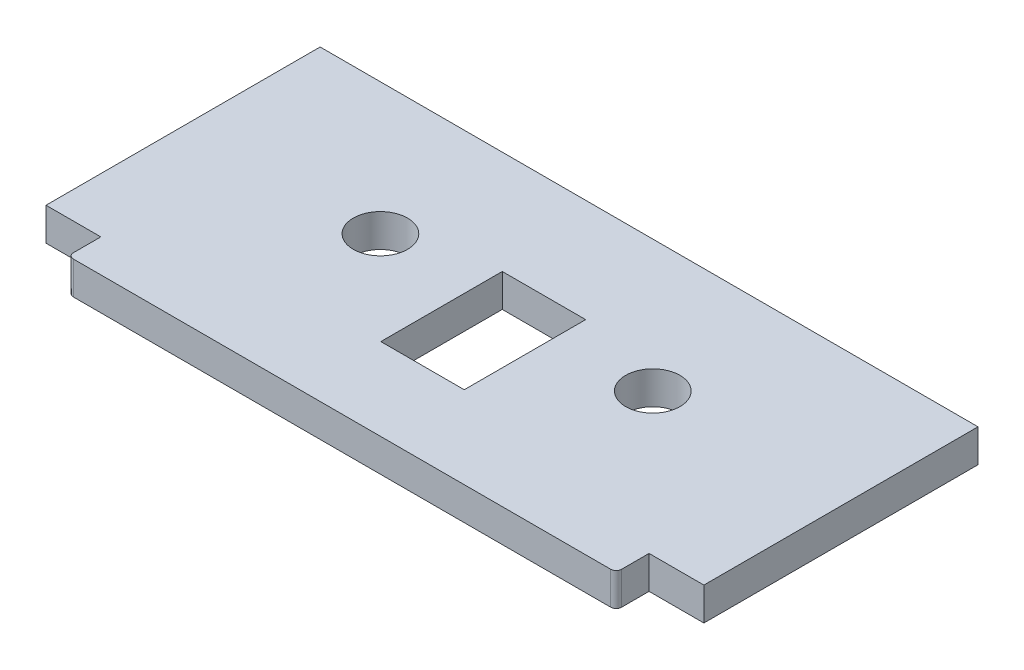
SolidWorks part; units mm, degrees
ref_plane "Front Plane" through (0, 0, 0) normal (0, 0, 1) x (1, 0, 0)
ref_plane "Top Plane" through (0, 0, 0) normal (0, 1, 0) x (1, 0, 0)
ref_plane "Right Plane" through (0, 0, 0) normal (1, 0, 0) x (0, 0, -1)
sketch "Sketch1" plane through (0, 0, 0) normal (0, 1, 0) x (1, 0, 0)
  line L0 (-24.6829, -7.1559) -> (26.6439, -7.1559) construction
  line L1 (-59.6829, 16.8441) -> (60.3171, 16.8441)
  line L2 (-59.6829, 16.8441) -> (-59.6829, -33.1559)
  line L3 (-59.6829, -33.1559) -> (-49.6829, -33.1559)
  line L4 (60.3171, 16.8441) -> (60.3171, -33.1559)
  line L8 (-49.6829, -33.1559) -> (-49.6829, -39.1559)
  line L14 (-7.6072, -18.1559) -> (-7.6072, -24.1559)
  line L15 (-49.6829, -39.1559) -> (50.3171, -39.1559)
  line L16 (50.3171, -39.1559) -> (50.3171, -33.1559)
  line L17 (50.3171, -33.1559) -> (60.3171, -33.1559)
  line L26 (-7.6072, -2.0054) -> (7.6072, -2.0054)
  line L27 (-7.6072, -2.0054) -> (-7.6072, -18.1559)
  line L29 (7.6072, -2.0054) -> (7.6072, -18.1559)
  line L30 (-7.6072, -2.0054) -> (7.6072, -18.1559) construction
  line L31 (-7.6072, -18.1559) -> (7.6072, -2.0054) construction
  line L32 (-7.6072, -24.1559) -> (7.6072, -24.1559)
  line L33 (7.6072, -24.1559) -> (7.6072, -18.1559)
  circle A1 centre (-24.6829, -7.1559) radius 4.95
  circle A2 centre (25, -7.1559) radius 4.95
  point P0 (0, -10.0807)
  point P6 (0, -0.4349)
  point P14 (0, -0.4349)
  dimension "D3" = 26
  dimension "D4" = 24.6829
  dimension "D6" = 9.9
  dimension "D10" = 25
  dimension "D1" = 50
  dimension "D2" = 120
  dimension "D5" = 6
  dimension "D7" = 100
  dimension "D8" = 10
  dimension "D9" = 6
extrude "Boss-Extrude2" add sketch "Sketch1" along normal blind 6
fillet "Fillet2" radius 1 2 edges at (-49.6829, 3, 39.1559) (50.3171, 3, 39.1559)
